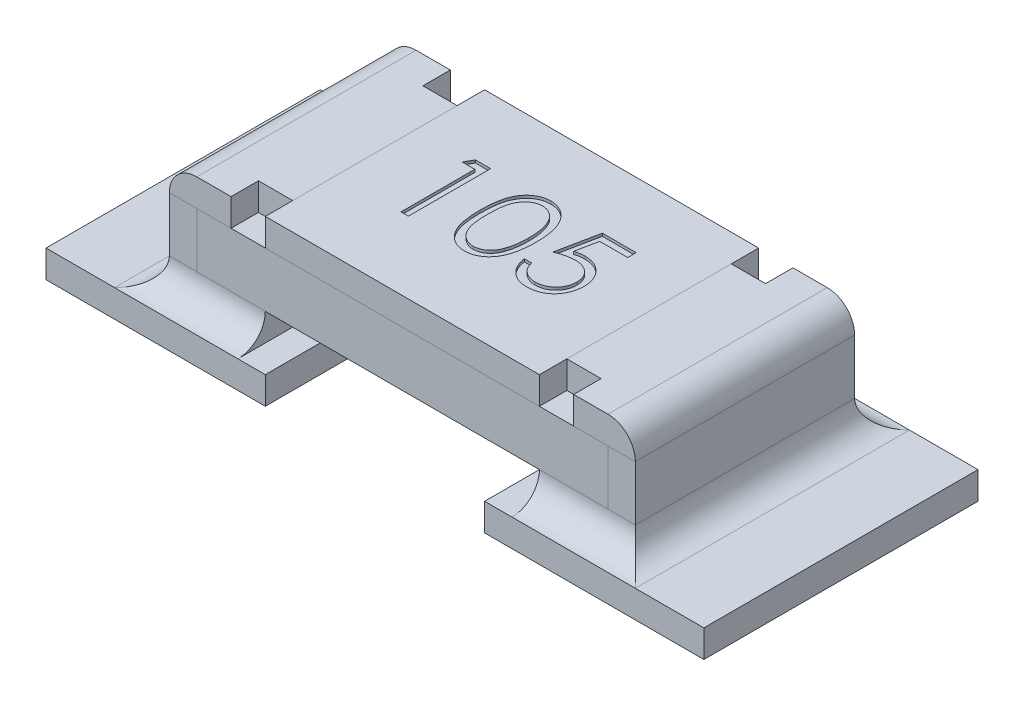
SolidWorks part; units mm, degrees
ref_plane "Plan de face" through (0, 0, 0) normal (0, 0, 1) x (1, 0, 0)
ref_plane "Plan de dessus" through (0, 0, 0) normal (0, 1, 0) x (1, 0, 0)
ref_plane "Plan de droite" through (0, 0, 0) normal (1, 0, 0) x (0, 0, -1)
sketch "Esquisse1" plane through (0, 0, 0) normal (0, 1, 0) x (1, 0, 0)
  line L0 (-0.4, 0) -> (0.4, 0) construction
  line L1 (-0.4, 0.5) -> (-1.2, 0.5)
  line L2 (-0.4, 0.5) -> (-0.4, -0.5)
  line L3 (-0.4, -0.5) -> (-1.2, -0.5)
  line L4 (-1.2, 0.5) -> (-1.2, -0.5)
  line L5 (0.4, 0.5) -> (1.2, 0.5)
  line L6 (0.4, 0.5) -> (0.4, -0.5)
  line L7 (0.4, -0.5) -> (1.2, -0.5)
  line L8 (1.2, 0.5) -> (1.2, -0.5)
  point P8 (-0.4, 0)
  point P12 (0, 0)
  dimension "D1" = 1
  dimension "D2" = 0.8
  dimension "D3" = 0.8
extrude "Boss.-Extru.1" add sketch "Esquisse1" along normal blind 0.1
sketch "Esquisse2" plane through (0, 0.1, 0) normal (0, 1, 0) x (1, 0, 0)
  line L0 (-0.4, 0.5) -> (-1.2, 0.5) construction
  line L1 (-0.85, 0.4) -> (-0.75, 0.4)
  line L2 (-0.85, 0.4) -> (-0.85, -0.4)
  line L3 (-0.85, -0.4) -> (-0.75, -0.4)
  line L4 (-0.75, 0.4) -> (-0.75, -0.4)
  line L5 (0.75, 0.4) -> (0.85, 0.4)
  line L6 (0.75, 0.4) -> (0.75, -0.4)
  line L7 (0.75, -0.4) -> (0.85, -0.4)
  line L8 (0.85, 0.4) -> (0.85, -0.4)
  line L9 (1.2, 0.5) -> (0.4, 0.5) construction
  line L10 (-1.2, -0.5) -> (-0.4, -0.5) construction
  point P8 (-0.8, 0.5)
  point P9 (0.8, 0.5)
  point P12 (-0.8, 0.4)
  point P15 (0.8, 0.4)
  dimension "D1" = 0.1
  dimension "D2" = 0.1
  dimension "D3" = 0.1
extrude "Boss.-Extru.2" add sketch "Esquisse2" along normal blind 0.3
sketch "Esquisse3" plane through (0, 0.1, 0) normal (0, 1, 0) x (1, 0, 0)
  line L0 (-0.85, -0.4) -> (-0.75, -0.4) construction
  line L1 (-0.75, 0.4) -> (-0.5, 0.4)
  line L2 (-0.75, 0.4) -> (-0.75, -0.4)
  line L3 (-0.75, -0.4) -> (-0.5, -0.4)
  line L4 (-0.5, 0.4) -> (-0.5, -0.4)
  line L5 (0.75, 0.4) -> (0.5, 0.4)
  line L6 (0.75, 0.4) -> (0.75, -0.4)
  line L7 (0.75, -0.4) -> (0.5, -0.4)
  line L8 (0.5, 0.4) -> (0.5, -0.4)
  line L9 (-0.4, -0.5) -> (-0.4, 0.5) construction
  line L10 (0.4, 0.5) -> (0.4, -0.5) construction
  dimension "D1" = 0.1
  dimension "D2" = 0.1
extrude "Boss.-Extru.3" add sketch "Esquisse3" along normal blind 0.1
fillet "Congé1" radius 0.1 3 edges at (-0.675, 0.1, -0.4) (-0.675, 0.1, 0.4) (-0.85, 0.1, 0)
fillet "Congé2" radius 0.1 3 edges at (0.675, 0.1, -0.4) (0.85, 0.1, 0) (0.675, 0.1, 0.4)
sketch "Esquisse4" plane through (0, 0.2, 0) normal (0, 1, 0) x (1, 0, 0)
  line L1 (-0.75, 0.4) -> (0.75, 0.4)
  line L2 (-0.75, 0.4) -> (-0.75, -0.4)
  line L3 (-0.75, -0.4) -> (0.75, -0.4)
  line L4 (0.75, 0.4) -> (0.75, -0.4)
extrude "Boss.-Extru.4" add sketch "Esquisse4" along normal blind 0.2 separate body
sketch "Esquisse5" plane through (0, 0.4, 0) normal (0, 1, 0) x (1, 0, 0)
  line L0 (0.75, 0.4) -> (-0.75, 0.4) construction
  line L1 (-0.5, 0.4) -> (0.5, 0.4)
  line L2 (-0.5, 0.4) -> (-0.5, -0.4)
  line L3 (-0.5, -0.4) -> (0.5, -0.4)
  line L4 (0.5, 0.4) -> (0.5, -0.4)
  line L5 (-0.75, -0.4) -> (0.75, -0.4) construction
  point P8 (0, 0.4)
  dimension "D1" = 1
extrude "Boss.-Extru.5" add sketch "Esquisse5" along normal blind 0.1 separate body
sketch "Esquisse6" plane through (0, 0.4, 0) normal (0, 1, 0) x (1, 0, 0)
  line L0 (-0.625, 0.4) -> (-0.85, 0.4)
  line L1 (-0.5, 0.4) -> (-0.75, 0.4) construction
  line L2 (-0.625, 0.4) -> (-0.625, 0.3)
  line L3 (-0.625, 0.3) -> (-0.5, 0.3)
  line L4 (-0.5, 0.4) -> (-0.5, -0.4) construction
  line L5 (-0.5, 0.3) -> (-0.5, -0.3)
  line L6 (-0.5, -0.3) -> (-0.625, -0.3)
  line L7 (-0.625, -0.3) -> (-0.625, -0.4)
  line L8 (-0.75, -0.4) -> (-0.5, -0.4) construction
  line L9 (-0.85, 0.4) -> (-0.85, -0.4)
  line L10 (-0.85, -0.4) -> (-0.625, -0.4)
  line L11 (0.625, -0.4) -> (0.85, -0.4)
  line L12 (0.85, -0.4) -> (0.85, 0.4)
  line L13 (0.75, 0.4) -> (0.5, 0.4) construction
  line L14 (0.625, 0.4) -> (0.625, 0.3)
  line L15 (0.625, 0.3) -> (0.5, 0.3)
  line L16 (0.5, -0.4) -> (0.5, 0.4) construction
  line L17 (0.5, 0.3) -> (0.5, -0.3)
  line L18 (0.85, 0.4) -> (0.625, 0.4)
  line L19 (-0.75, -0.4) -> (0.75, -0.4) construction
  line L21 (0.5, -0.3) -> (0.625, -0.3)
  line L22 (0.625, -0.3) -> (0.625, -0.4)
  dimension "D1" = 0.1
  dimension "D2" = 0.1
extrude "Boss.-Extru.6" add sketch "Esquisse6" along normal blind 0.1 separate body
fillet "Congé3" radius 0.1 1 edges at (-0.85, 0.5, 0)
fillet "Congé4" radius 0.1 1 edges at (0.85, 0.5, 0)
sketch "Esquisse7" plane through (0, 0.5, 0) normal (0, 1, 0) x (1, 0, 0)
  line L0 (-0.3705, -0.1382) -> (0.3746, -0.1382) construction
  text T0 "105" font "Century Gothic" height 0.3
extrude "Enlèv. mat.-Extru.1" cut sketch "Esquisse7" against normal blind 0.01
